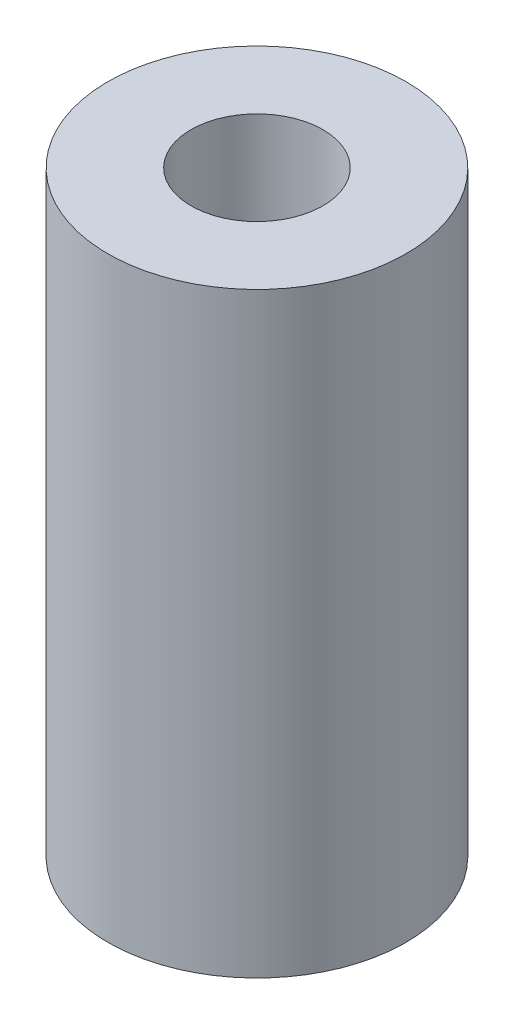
SolidWorks part; units mm, degrees
ref_plane "Front" through (0, 0, 0) normal (0, 0, 1) x (1, 0, 0)
ref_plane "Top" through (0, 0, 0) normal (0, 1, 0) x (1, 0, 0)
ref_plane "Right" through (0, 0, 0) normal (1, 0, 0) x (0, 0, -1)
sketch "Sketch1" plane through (0, 0, 0) normal (0, 1, 0) x (1, 0, 0)
  circle A0 centre (0, 0) radius 4.7625
  dimension "D1" = 9.525
extrude "Extrude1" add sketch "Sketch1" along normal blind 19.05
sketch "Sketch2" plane through (0, 0, 0) normal (0, 1, 0) x (1, 0, 0)
  circle A0 centre (0, 0) radius 2.1082
  dimension "D1" = 4.2164
extrude "Cut-Extrude2" cut sketch "Sketch2" along normal through all
